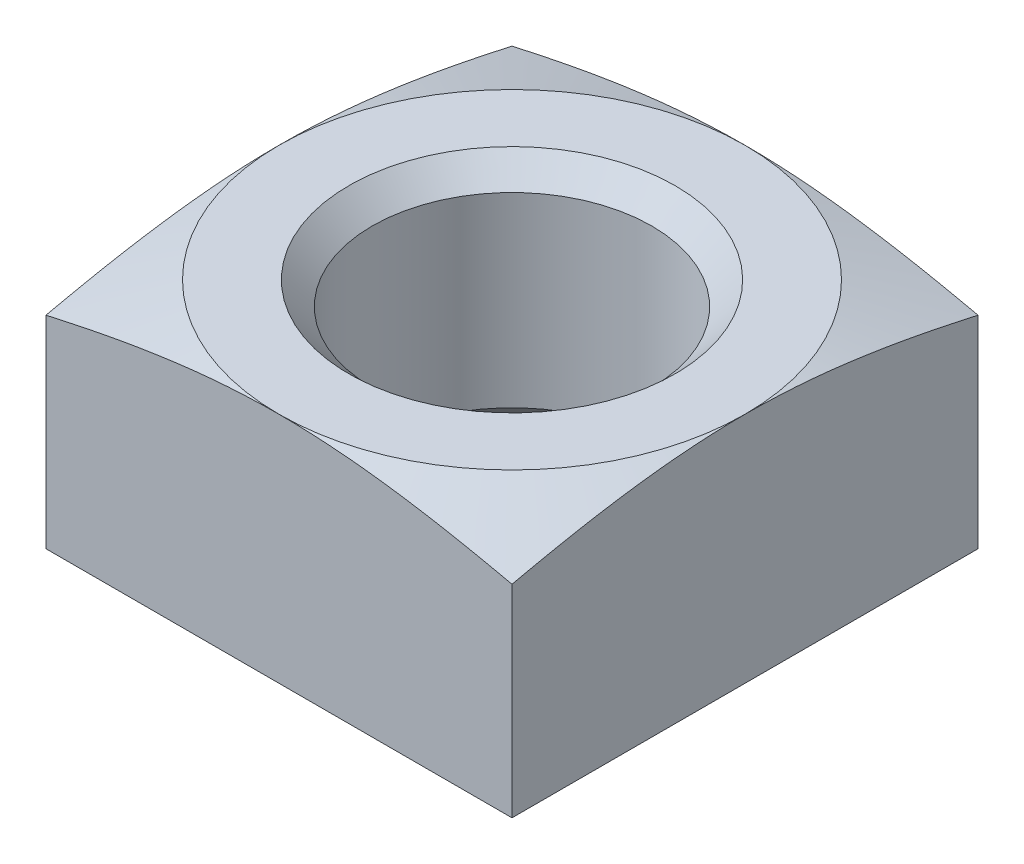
SolidWorks part; units mm, degrees
ref_plane "Front Plane" through (0, 0, 0) normal (0, 0, 1) x (1, 0, 0)
ref_plane "Top Plane" through (0, 0, 0) normal (0, 1, 0) x (1, 0, 0)
ref_plane "Right Plane" through (0, 0, 0) normal (1, 0, 0) x (0, 0, -1)
sketch "Sketch6" plane through (0, 0, 0) normal (1, 0, 0) x (0, 0, -1)
  line L0 (0, 59.8384) -> (0, -60.7908) construction
sketch "Sketch8" plane through (0, 0, 0) normal (1, 0, 0) x (0, 0, -1)
  line L1 (5, 2.5) -> (-5, 2.5)
  line L2 (5, 2.5) -> (5, -2.5)
  line L3 (5, -2.5) -> (-5, -2.5)
  line L4 (-5, 2.5) -> (-5, -2.5)
  line L5 (5, 2.5) -> (-5, -2.5) construction
  line L6 (5, -2.5) -> (-5, 2.5) construction
  point P0 (0, 0)
  dimension "D1" = 5
  dimension "D2" = 10
extrude "Boss-Extrude2" add sketch "Sketch8" along normal mid plane 10
sketch "Sketch10" plane through (0, 0, 0) normal (1, 0, 0) x (0, 0, -1)
  line L0 (-5, 2.5) -> (-7.2, 2.5)
  line L1 (-7.2, 2.5) -> (-7.2, 1.8)
  line L2 (-7.2, 1.8) -> (-5, 2.5)
  point P0 (-5, 2.5)
  point P6 (-5, 2.5)
  dimension "D1" = 0.7
  dimension "D2" = 2.2
revolve "Cut-Revolve1" cut sketch "Sketch10" angle 360 about L0
sketch "Sketch11" plane through (0, 2.5, 0) normal (0, 1, 0) x (1, 0, 0)
  circle A0 centre (0, 0) radius 3
  dimension "D1" = 6
extrude "Cut-Extrude1" cut sketch "Sketch11" against normal up to surface (5 mm away)
chamfer "Chamfer1" distance 0.5 angle 45 2 edges at (0, 2.5, 3) (0, -2.5, 3)
